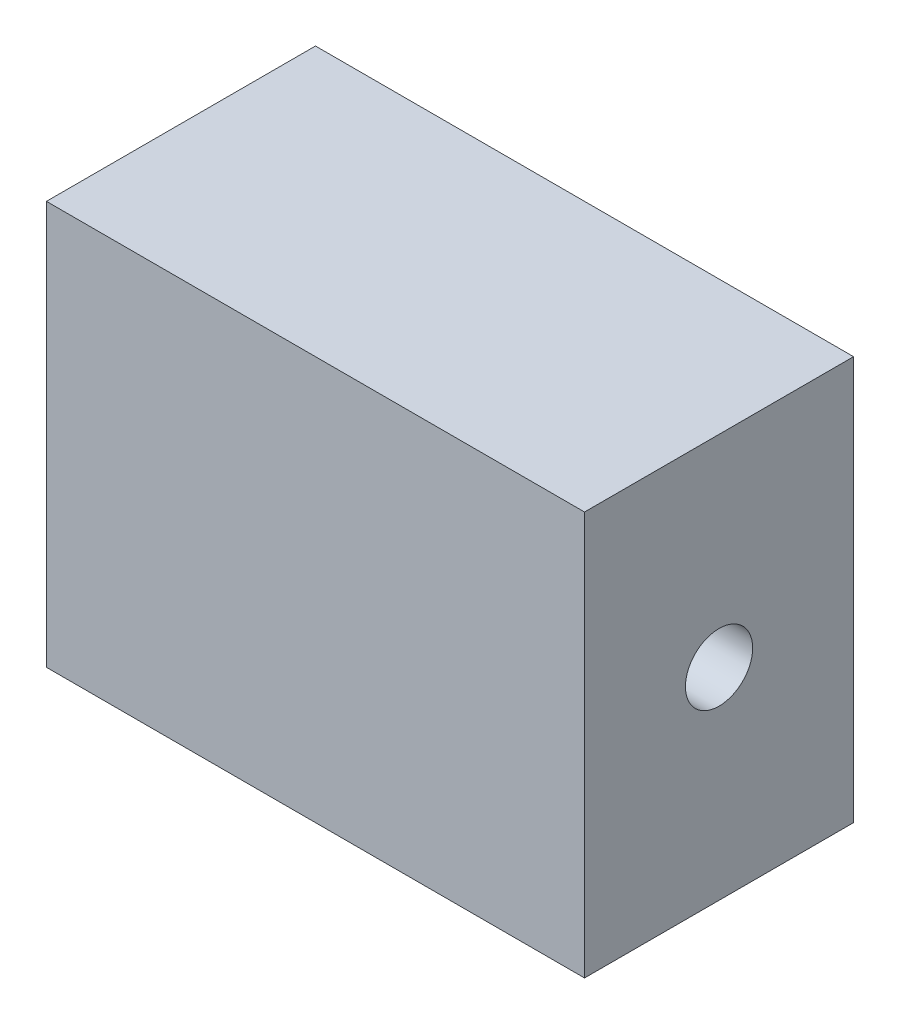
SolidWorks part; units mm, degrees
ref_plane "Front Plane" through (0, 0, 0) normal (0, 0, 1) x (1, 0, 0)
ref_plane "Top Plane" through (0, 0, 0) normal (0, 1, 0) x (1, 0, 0)
ref_plane "Right Plane" through (0, 0, 0) normal (1, 0, 0) x (0, 0, -1)
sketch "Sketch1" plane through (0, 0, 0) normal (0, 0, 1) x (1, 0, 0)
  line L1 (0, 0) -> (40, 0)
  line L2 (0, 0) -> (0, 30)
  line L3 (0, 30) -> (40, 30)
  line L4 (40, 0) -> (40, 30)
  dimension "D1" = 40
  dimension "D2" = 30
extrude "Boss-Extrude1" add sketch "Sketch1" along normal blind 20
sketch "Sketch2" plane through (40, 0, 0) normal (1, 0, 0) x (0, 0, -1)
  line L0 (-10, 30) -> (-10, 15) construction
  line L1 (-20, 30) -> (0, 30) construction
  circle A0 centre (-10, 15) radius 2.5
  dimension "D1" = 5
  dimension "D2" = 15
extrude "Cut-Extrude1" cut sketch "Sketch2" against normal blind 20
